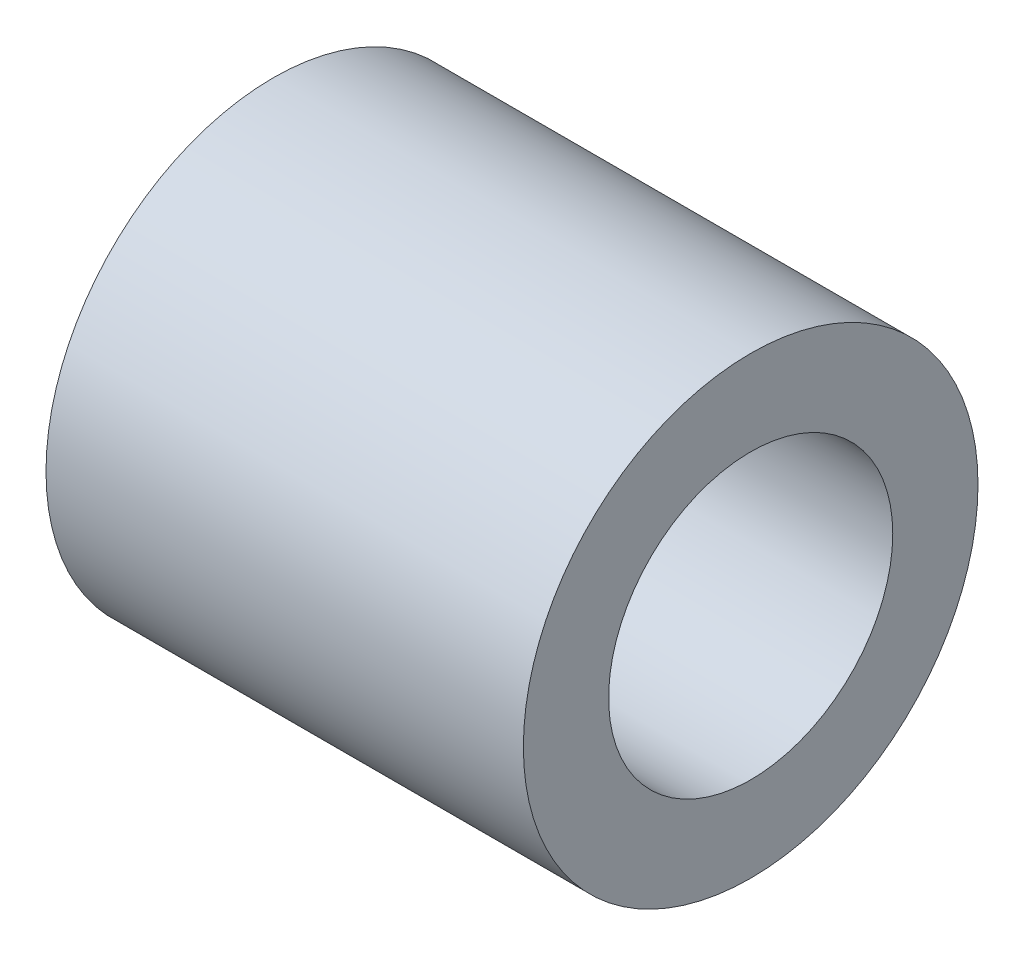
SolidWorks part; units mm, degrees
ref_plane "Plano frontal" through (0, 0, 0) normal (0, 0, 1) x (1, 0, 0)
ref_plane "Plano superior" through (0, 0, 0) normal (0, 1, 0) x (1, 0, 0)
ref_plane "Plano direito" through (0, 0, 0) normal (1, 0, 0) x (0, 0, -1)
sketch "Esboço1" plane through (0, 0, 0) normal (1, 0, 0) x (0, 0, -1)
  circle A1 centre (0, 0) radius 2
  dimension "D1" = 4
extrude "Ressalto-extrusão1" add sketch "Esboço1" along normal blind 4.1
sketch "Esboço2" plane through (0, 0, 0) normal (1, 0, 0) x (0, 0, -1)
  circle A0 centre (0, 0) radius 2
  dimension "D1" = 4
extrude "Ressalto-extrusão2" add sketch "Esboço2" against normal blind 0.1
sketch "Esboço4" plane through (0, 0, 0) normal (1, 0, 0) x (0, 0, -1)
  circle A0 centre (0, 0) radius 1.25
  dimension "D1" = 2.5
extrude "Corte-extrusão1" cut sketch "Esboço4" against normal up to next and the other way up to next
sketch "Esboço5" [suppressed] plane through (0, 0, 0) normal (1, 0, 0) x (0, 0, -1)
  circle A0 centre (0, 0) radius 1.975
  dimension "D1" = 3.95
extrude "Ressalto-extrusão3" [suppressed] add sketch "Esboço5" against normal blind 5.6
